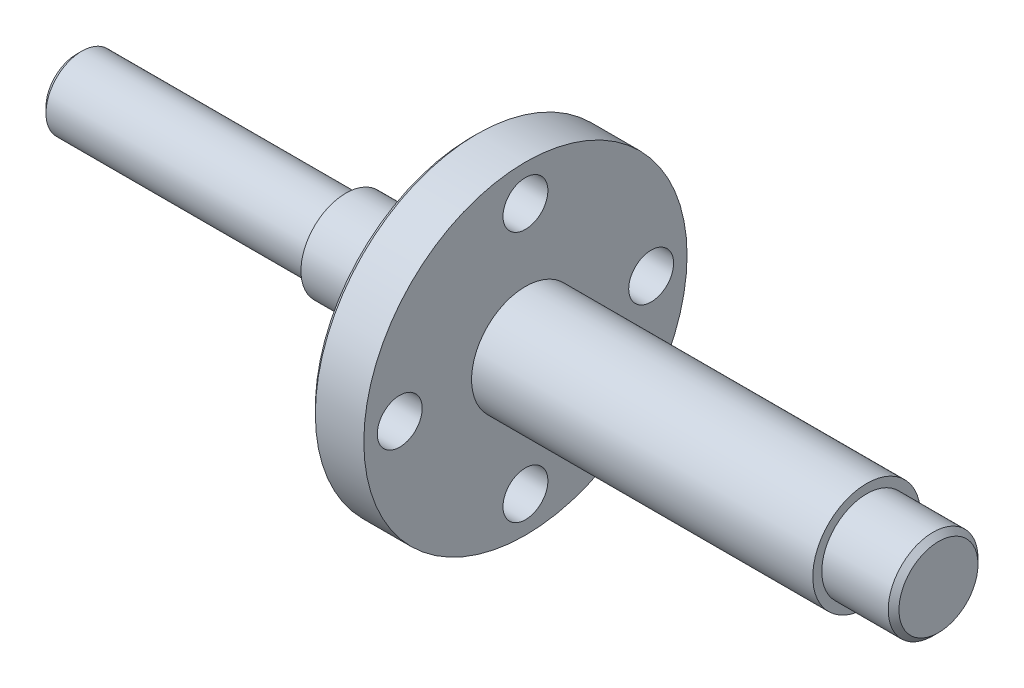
SolidWorks part; units mm, degrees
ref_plane "前视基准面" through (0, 0, 0) normal (0, 0, 1) x (1, 0, 0)
ref_plane "上视基准面" through (0, 0, 0) normal (0, 1, 0) x (1, 0, 0)
ref_plane "右视基准面" through (0, 0, 0) normal (1, 0, 0) x (0, 0, -1)
sketch "草图1" plane through (0, 0, 0) normal (1, 0, 0) x (0, 0, -1)
  circle A0 centre (0, 0) radius 2
  dimension "D1" = 4
extrude "凸台-拉伸1" add sketch "草图1" along normal blind 15
sketch "草图2" plane through (15, 0, 0) normal (1, 0, 0) x (0, 0, -1)
  circle A0 centre (0, 0) radius 2.5
  dimension "D1" = 5
extrude "凸台-拉伸2" add sketch "草图2" along normal blind 4
sketch "草图3" plane through (19, 0, 0) normal (1, 0, 0) x (0, 0, -1)
  circle A0 centre (0, 0) radius 3
  dimension "D1" = 6
extrude "凸台-拉伸3" add sketch "草图3" along normal blind 3
sketch "草图4" plane through (22, 0, 0) normal (1, 0, 0) x (0, 0, -1)
  circle A0 centre (0, 0) radius 9
  dimension "D1" = 18
extrude "凸台-拉伸4" add sketch "草图4" along normal blind 3
sketch "草图5" plane through (25, 0, 0) normal (1, 0, 0) x (0, 0, -1)
  circle A0 centre (0, 0) radius 3
  dimension "D1" = 6
extrude "凸台-拉伸5" add sketch "草图5" along normal blind 19
sketch "草图8" plane through (44, 0, 0) normal (1, 0, 0) x (0, 0, -1)
  circle A0 centre (0, 0) radius 2.5
  dimension "D1" = 5
extrude "凸台-拉伸6" add sketch "草图8" along normal blind 4
hole_wizard "M3 螺纹孔2" positions "草图10" profile "草图9" tap size "M3" standard "Gb"
sketch "草图10" plane through (22, 0, 0) normal (-1, 0, 0) x (0, 0, 1)
  point P0 (0, 7)
  dimension "D1" = 7
sketch "草图9" plane through (22, 7, 0) normal (0, 1, 0) x (0, 0, 1)
  line L0 (0, 0) -> (0, 3.001)
  line L1 (0, 3.001) -> (1.25, 3.001)
  line L2 (1.25, 3.001) -> (1.25, 0)
  line L5 (1.25, 0) -> (0, 0)
  line L11 (0, -6.35) -> (0, 107.95) construction
  dimension "通孔螺纹孔钻头直径" = 2.5
  dimension "通孔螺纹孔钻头深度" = 3.001
pattern_circular "阵列(圆周)2" count 4 over 360 about axis through (0, 0, 0) along (1, 0, 0) of "M3 螺纹孔2"
chamfer "倒角1" distance 0.3 angle 45 3 edges at (22, 0, -9) (0, 0, -2) (48, 0, -2.5)
